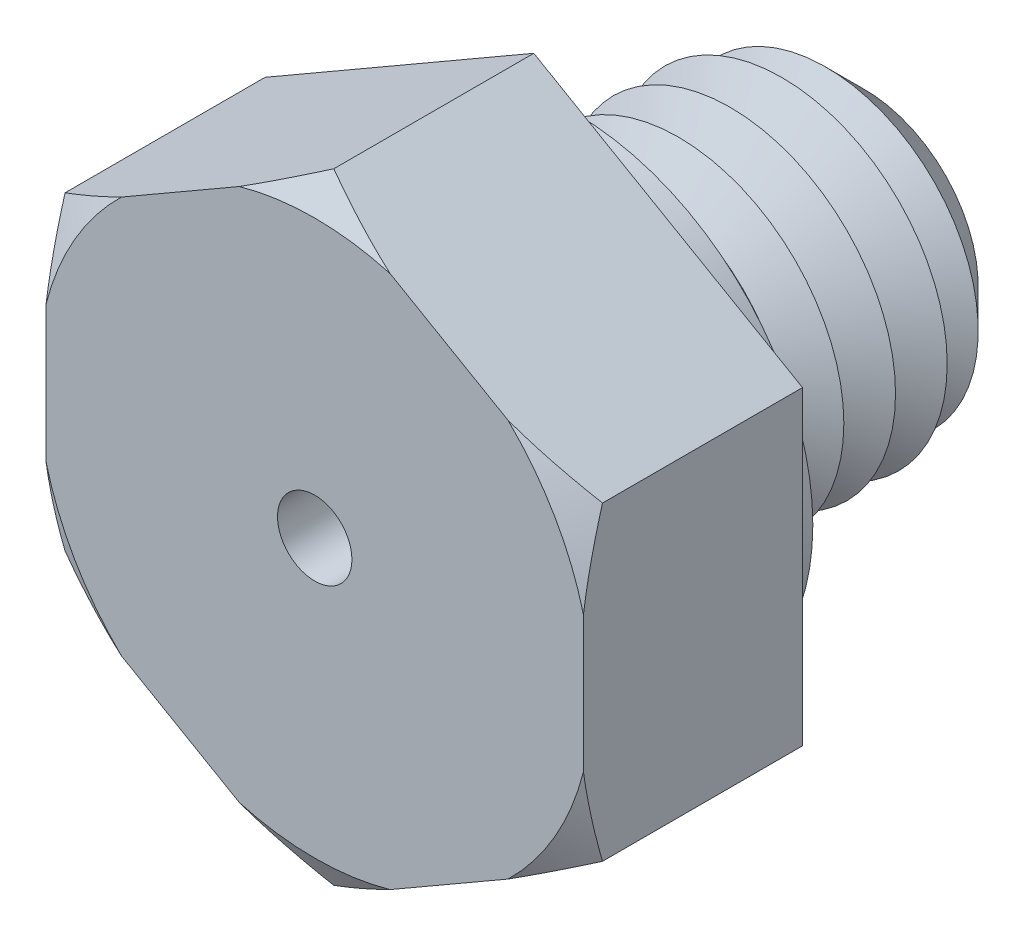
SolidWorks part; units mm, degrees
ref_plane "Front Plane" through (0, 0, 0) normal (0, 0, 1) x (1, 0, 0)
ref_plane "Top Plane" through (0, 0, 0) normal (0, 1, 0) x (1, 0, 0)
ref_plane "Right Plane" through (0, 0, 0) normal (1, 0, 0) x (0, 0, -1)
sketch "Sketch2" plane through (0, 0, 0) normal (0, 0, 1) x (1, 0, 0)
  line L1 (0, 7.5056) -> (-6.5, 3.7528)
  line L2 (-6.5, 3.7528) -> (-6.5, -3.7528)
  line L3 (-6.5, -3.7528) -> (0, -7.5056)
  line L4 (0, -7.5056) -> (6.5, -3.7528)
  line L5 (6.5, -3.7528) -> (6.5, 3.7528)
  line L6 (6.5, 3.7528) -> (0, 7.5056)
  circle A0 centre (0, 0) radius 6.5 construction
  dimension "D1" = 13
extrude "Boss-Extrude1" add sketch "Sketch2" along normal blind 5.3
sketch "Sketch3" plane through (0, 0, 0) normal (0, 0, -1) x (-1, 0, 0)
  circle A0 centre (0, 0) radius 4
  dimension "D1" = 8
extrude "Boss-Extrude2" add sketch "Sketch3" along normal blind 8
sketch "Sketch4" plane through (0, 0, 0) normal (0, 0, -1) x (-1, 0, 0)
  circle A0 centre (0, 0) radius 5.75
  dimension "D1" = 11.5
extrude "Boss-Extrude3" add sketch "Sketch4" along normal blind 1
sketch "Sketch5" plane through (0, 0, 0) normal (1, 0, 0) x (0, 0, -1)
  line L0 (-3.2117, 0) -> (6.3192, 0) construction
chamfer "Chamfer1" distance 1.25 angle 45 1 edges at (-4, 0, -8)
sketch "Sketch6" plane through (0, 0, 0) normal (1, 0, 0) x (0, 0, -1)
  line L0 (1, 4) -> (1.625, 2.9175)
  line L1 (1.625, 2.9175) -> (2.25, 4)
  line L2 (6.75, 4) -> (1, 4) construction
  line L3 (2.25, 4) -> (1, 4)
  dimension "D1" = 1.25
revolve "Cut-Revolve1" cut sketch "Sketch6" angle 360 about L0
pattern_linear "LPattern1" count 5 spacing 1.25 along (0, 0, -1) of "Cut-Revolve1"
sketch "Sketch7" plane through (0, 0, 0) normal (1, 0, 0) x (0, 0, -1)
  line L0 (-5.3, 7.5056) -> (-5.3, 6.7056)
  line L1 (-5.3, 3.7528) -> (-5.3, 7.5056) construction
  line L2 (-5.3, 6.7056) -> (-4.8381, 7.5056)
  line L3 (-5.3, 7.5056) -> (0, 7.5056) construction
  line L4 (-4.8381, 7.5056) -> (-5.3, 7.5056)
  dimension "D1" = 0.8
  dimension "D2" = 30
revolve "Cut-Revolve2" cut sketch "Sketch7" angle 360 about L0
sketch "Sketch8" plane through (0, 0, 5.3) normal (0, 0, 1) x (1, 0, 0)
  circle A0 centre (0, 0) radius 0.9
  dimension "D1" = 1.8
extrude "Cut-Extrude1" cut sketch "Sketch8" against normal up to surface (13.3 mm away)
